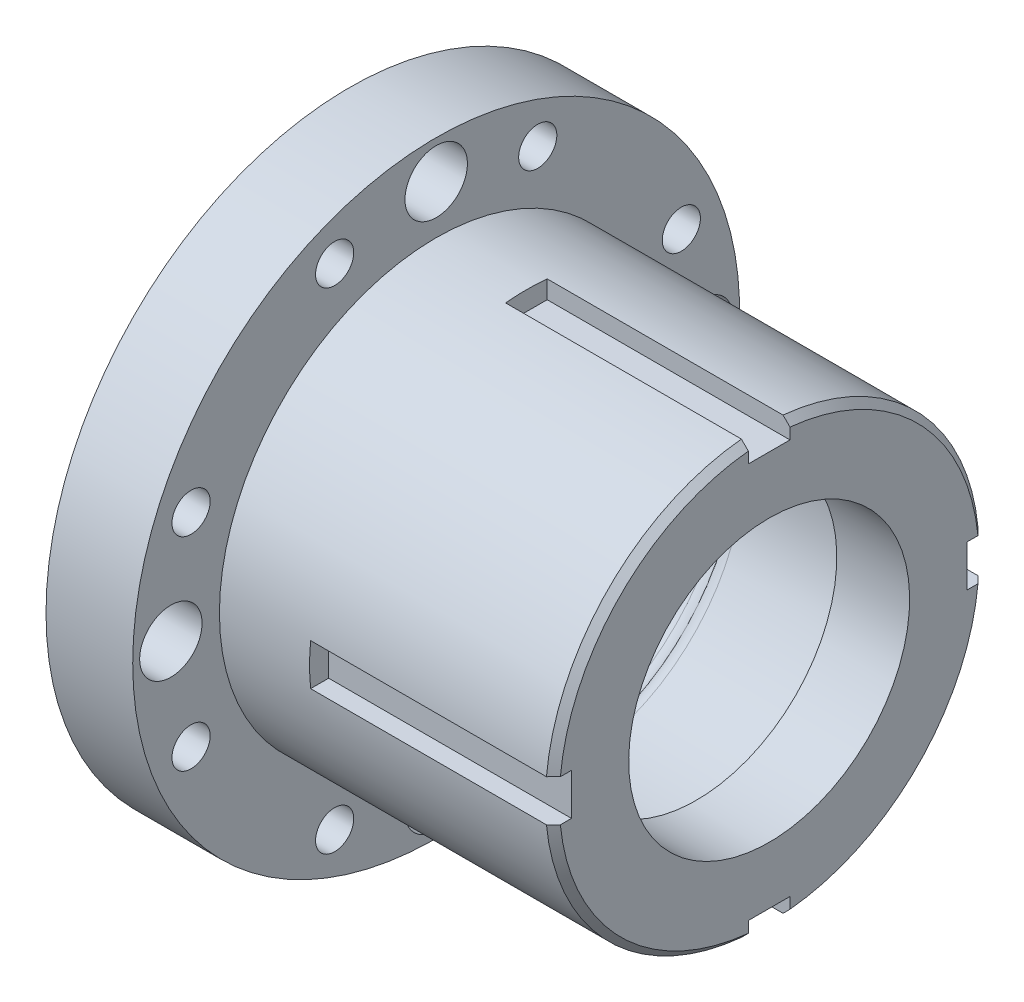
SolidWorks part; units mm, degrees
ref_plane "Plan de face" through (0, 0, 0) normal (0, 0, 1) x (1, 0, 0)
ref_plane "Plan de dessus" through (0, 0, 0) normal (0, 1, 0) x (1, 0, 0)
ref_plane "Plan de droite" through (0, 0, 0) normal (1, 0, 0) x (0, 0, -1)
sketch "Esquisse1" plane through (0, 0, 0) normal (0, 0, 1) x (1, 0, 0)
  line L0 (0, 27.5) -> (120.9998, 27.5)
  line L1 (120.9998, 60.4996) -> (120.9998, 27.5)
  line L2 (0, 87.4999) -> (0, 27.5)
  line L3 (25, 62.4996) -> (118.9998, 62.4996)
  line L18 (0, 87.4999) -> (25, 87.4999)
  line L22 (25, 87.4999) -> (25, 62.4996)
  line L32 (118.9998, 62.4996) -> (120.9998, 60.4996)
  line L42 (-102.5038, 0) -> (250.4656, 0) construction
  dimension "D1" = 25
  dimension "D2" = 93.9998
  dimension "D3" = 27.5
  dimension "D4" = 87.4999
  dimension "D6" = 25.0003
  dimension "D7" = 32.9996
  dimension "D8" = 2
revolve "Révolution1" add sketch "Esquisse1" angle 360 about L42
sketch "Esquisse3" plane through (0, 0, 0) normal (-1, 0, 0) x (0, 0, 1)
  line L0 (0, 95.6859) -> (0, 0) construction
  line L1 (0, 0) -> (-40.0963, 96.8011) construction
  line L2 (0.001, 0) -> (-29.2753, 70.6768) construction
  line L3 (0.001, 0) -> (29.2756, 70.6775) construction
  circle A0 centre (0, 0) radius 76.5 construction
  circle A1 centre (-29.2753, 70.6768) radius 5.5
  circle A2 centre (29.2756, 70.6775) radius 5.5
  dimension "D2" = 153
  dimension "D3" = 11
  dimension "D1" = 22.5
  dimension "D4" = 45
extrude "Extrusion2" cut sketch "Esquisse3" against normal blind 35
pattern_circular "Répétition circulaire1" count 4 over 360 about axis through (0, 0, 0) along (1, 0, 0) of "Extrusion2"
sketch "Esquisse4" plane through (0, 0, 0) normal (-1, 0, 0) x (0, 0, 1)
  line L0 (0, 100.9225) -> (0, 0) construction
  circle A0 centre (0, 0) radius 76.5 construction
  circle A1 centre (0, 0) radius 76.5 construction
  circle A2 centre (0, 76.5) radius 9
  circle A3 centre (76.5, 0) radius 9
  circle A4 centre (0, -76.5) radius 9
  circle A5 centre (-76.5, 0) radius 9
  dimension "D1" = 18
extrude "Extrusion3" cut sketch "Esquisse4" against normal blind 35
ref_plane "Plan1" through (0, 0, 0) normal (0, 0, -1) x (-1, 0, 0)
ref_plane "Plan2" through (71.9999, -62.4996, 0) normal (0, -1, 0) x (0, 0, 1)
sketch "Esquisse5" plane through (71.9999, -62.4996, 0) normal (0, -1, 0) x (0, 0, 1)
  line L0 (0, 82.3321) -> (0, -30.9463) construction
  line L2 (62.4996, 46.9999) -> (-62.4996, 46.9999) construction
  circle A0 centre (0, 21.0001) radius 6
  dimension "D2" = 12
  dimension "D1" = 25.9998
extrude "Extrusion4" cut sketch "Esquisse5" against normal blind 35
sketch "Esquisse6" plane through (120.9998, 0, 0) normal (1, 0, 0) x (0, 0, -1)
  line L1 (6, 57) -> (-6, 57)
  line L2 (6, 57) -> (6, 65.5123)
  line L3 (6, 65.5123) -> (-6, 65.5123)
  line L4 (-6, 57) -> (-6, 65.5123)
  dimension "D1" = 12
  dimension "D2" = 6
  dimension "D3" = 57
extrude "Extrusion5" cut sketch "Esquisse6" against normal blind 70
pattern_circular "Répétition circulaire2" count 4 every 90 about axis through (0, 0, 0) along (1, 0, 0) of "Extrusion5"
sketch "Esquisse8" plane through (120.9998, 0, 0) normal (1, 0, 0) x (0, 0, -1)
  circle A0 centre (0, 0) radius 40.5
  dimension "D1" = 81
extrude "Extrusion7" cut sketch "Esquisse8" against normal through all
sketch "Esquisse9" plane through (0, 0, 0) normal (-1, 0, 0) x (0, 0, 1)
  circle A0 centre (0, 0) radius 50
  dimension "D1" = 100
extrude "Extrusion8" cut sketch "Esquisse9" against normal blind 100
sketch "Esquisse10" plane through (0, 0, 0) normal (-1, 0, 0) x (0, 0, 1)
  circle A0 centre (0, 0) radius 65.5
  circle A1 centre (0, 0) radius 62.5
  dimension "D1" = 131
  dimension "D2" = 125
extrude "Extrusion9" cut sketch "Esquisse10" against normal blind 1.5
fillet "Congé2" radius 1.5 2 edges at (1.5, 0, 65.5) (1.5, 0, 62.5)
sketch "Esquisse11" plane through (0, 0, 0) normal (-1, 0, 0) x (0, 0, 1)
  circle A0 centre (0, 0) radius 55
  dimension "D1" = 110
extrude "Extrusion10" cut sketch "Esquisse11" against normal blind 60
fillet "Congé3" radius 5 1 edges at (60, 0, 55)
fillet "Congé4" radius 5 2 edges at (60, -50, 0) (60, 50, 0)
